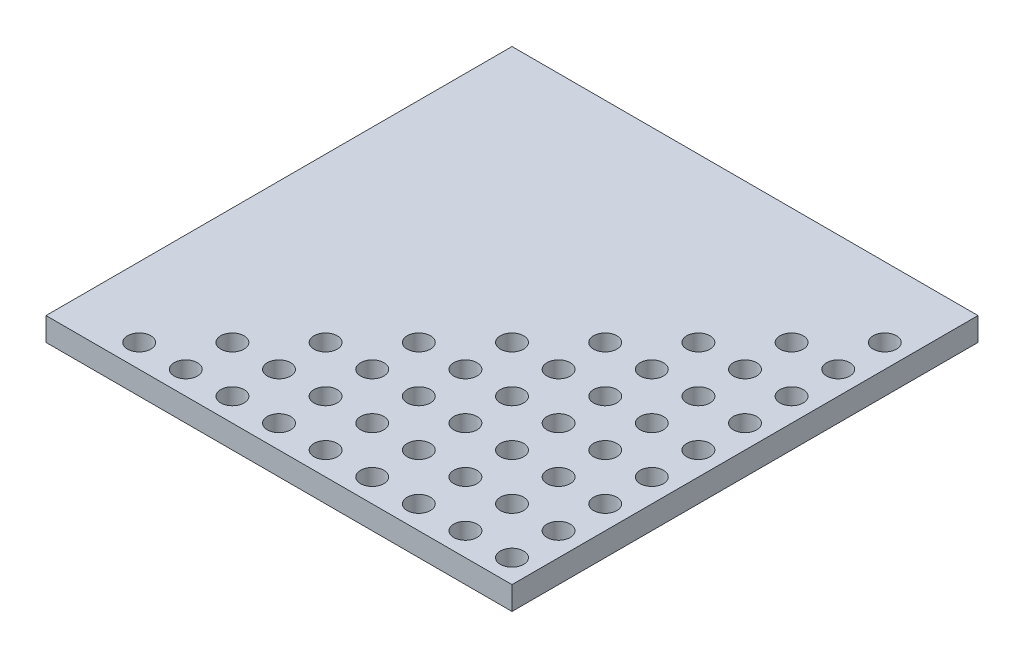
SolidWorks part; units mm, degrees
ref_plane "Front Plane" through (0, 0, 0) normal (0, 0, 1) x (1, 0, 0)
ref_plane "Top Plane" through (0, 0, 0) normal (0, 1, 0) x (1, 0, 0)
ref_plane "Right Plane" through (0, 0, 0) normal (1, 0, 0) x (0, 0, -1)
sketch "Sketch1" plane through (0, 0, 0) normal (0, 1, 0) x (1, 0, 0)
  line L0 (0, 0) -> (100, 0)
  line L1 (100, 0) -> (100, 100)
  line L2 (100, 100) -> (0, 100)
  line L3 (0, 100) -> (0, 0)
  dimension "D1" = 100
  dimension "D2" = 100
extrude "Extrude1" add sketch "Sketch1" along normal blind 5
sketch "Sketch2" plane through (0, 5, 0) normal (0, 1, 0) x (-1, 0, 0)
  line L0 (0, 0) -> (-100, 0) construction
  line L1 (-100, 0) -> (-100, -100) construction
  circle A0 centre (-95, -5) radius 2.5
  dimension "D1" = 5
  dimension "D3" = 5
  dimension "D2" = 5
extrude "Cut-Extrude1" cut sketch "Sketch2" against normal through all
sketch "Sketch3" plane through (0, 5, 0) normal (0, 1, 0) x (-1, 0, 0)
  line L0 (0, 0) -> (-100, -100)
  line L1 (-100, -100) -> (-100, 0)
  line L2 (-100, 0) -> (0, 0)
other "Fill Pattern1" parameters "D4"=10, "D5"=10, "D3"=0
